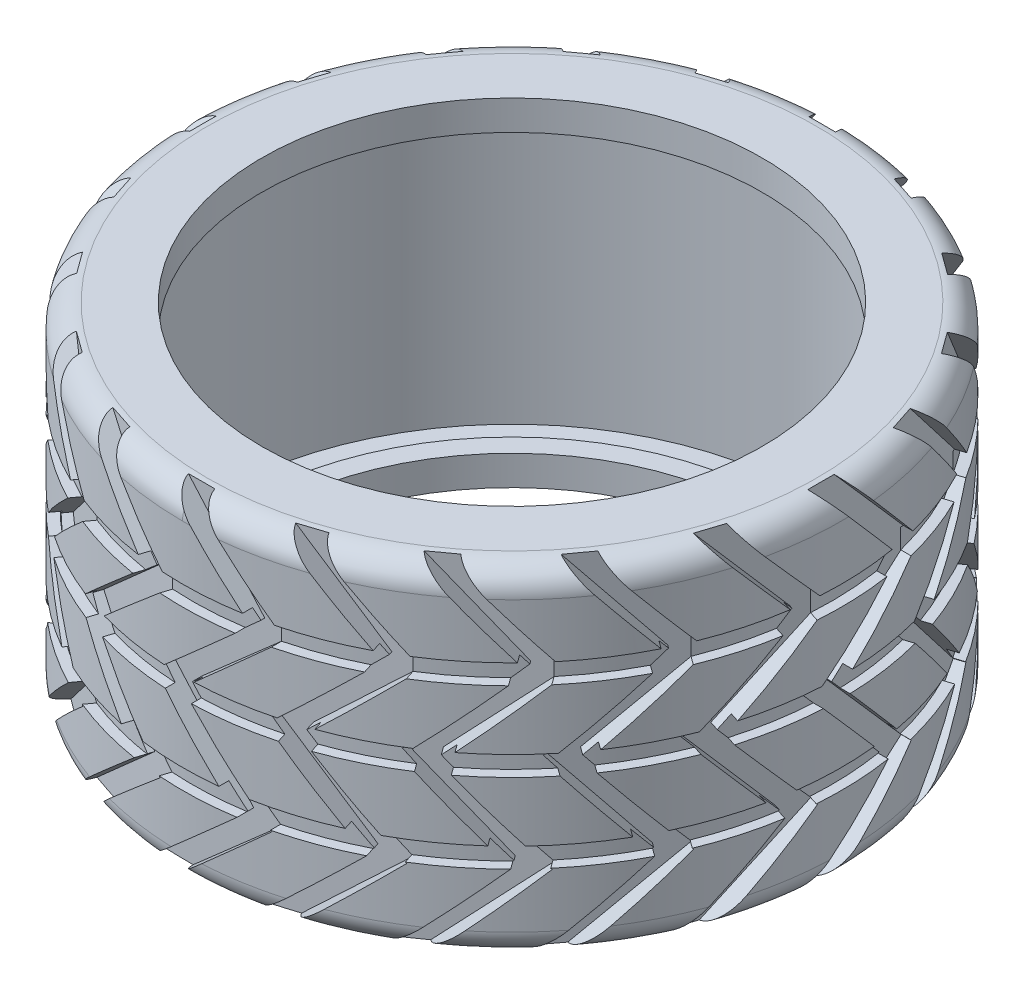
SolidWorks part; units mm, degrees
ref_plane "Front Plane" through (0, 0, 0) normal (0, 0, 1) x (1, 0, 0)
ref_plane "Top Plane" through (0, 0, 0) normal (0, 1, 0) x (1, 0, 0)
ref_plane "Right Plane" through (0, 0, 0) normal (1, 0, 0) x (0, 0, -1)
sketch "Sketch1" plane through (0, 0, 0) normal (0, 0, 1) x (1, 0, 0)
  line L0 (0, 83.6379) -> (0, -103.1897) construction
  line L1 (30.7, -17) -> (25.2, -17)
  line L2 (25.2, -17) -> (25.2, -14)
  line L3 (25.2, -14) -> (27.2, -14)
  line L4 (27.2, -14) -> (27.2, -15)
  line L5 (30.2, 15) -> (30.2, -15)
  line L6 (27.2, -15) -> (30.2, -15)
  line L7 (27.2, 15) -> (30.2, 15)
  line L8 (27.2, 14) -> (27.2, 15)
  line L9 (25.2, 14) -> (27.2, 14)
  line L10 (-63.3434, 0) -> (33.2, 0) construction
  line L11 (25.2, 17) -> (25.2, 14)
  line L12 (33.2, 14.5) -> (33.2, -14.5)
  line L13 (30.7, 17) -> (25.2, 17)
  arc A0 (33.2, -14.5) -> (30.7, -17) centre (30.7, -14.5) cw
  arc A1 (33.2, 14.5) -> (30.7, 17) centre (30.7, 14.5) ccw
  point P19 (34, -19)
  point P21 (30.2, 0)
  point P24 (34, 19)
  dimension "D8" = 2.5
  dimension "D1" = 30.2
  dimension "D2" = 2
  dimension "D3" = 2
  dimension "D4" = 15
  dimension "D5" = 3
  dimension "D6" = 3
  dimension "D7" = 3
revolve "Revolve1" add sketch "Sketch1" angle 360 about L0
sketch "Sketch2" plane through (0, 0, 0) normal (0, 0, 1) x (1, 0, 0)
  line L0 (-5.8704, 0) -> (53.8139, 0) construction
  line L1 (32.2, 9) -> (35.7422, 9)
  line L2 (32.2, 9) -> (32.2, 7)
  line L3 (32.2, 7) -> (35.7422, 7)
  line L4 (35.7422, 9) -> (35.7422, 7)
  line L5 (32.2, 1) -> (35.7422, 1)
  line L6 (32.2, 1) -> (32.2, -1)
  line L7 (32.2, -1) -> (35.7422, -1)
  line L8 (35.7422, 1) -> (35.7422, -1)
  line L9 (32.2, -7) -> (35.7422, -7)
  line L10 (32.2, -7) -> (32.2, -9)
  line L11 (32.2, -9) -> (35.7422, -9)
  line L12 (35.7422, -7) -> (35.7422, -9)
  line L13 (33.2, -14.5) -> (33.2, 14.5) construction
  line L14 (0, 29.8282) -> (0, -32.6074) construction
  line L15 (0, -32.6074) -> (-0.69, -32.6074) construction
  dimension "D1" = 2
  dimension "D2" = 1
  dimension "D3" = 9
revolve "Cut-Revolve1" cut sketch "Sketch2" angle 360 about L14
ref_plane "Plane1" through (33.2, 0, 0) normal (1, 0, 0) x (0, 0, -1)
sketch "Sketch3" plane through (33.2, 0, 0) normal (1, 0, 0) x (0, 0, -1)
  line L0 (0, 0) -> (9.1133, 8)
  line L1 (9.1133, 8) -> (1.1133, 17.1133)
  line L2 (0, 0) -> (8, -9.1133)
  line L3 (8, -9.1133) -> (-1.1133, -17.1133)
  line L4 (2.3901, 8) -> (13.9243, 8) construction
  line L5 (0, 18.3998) -> (0, -22.4709) construction
  line L6 (6.2909, 8.1836) -> (-0.3897, 15.7939) construction
  line L7 (1.1133, 17.1133) -> (-1.548, 17.1133)
  line L8 (-0.2479, 15.6324) -> (-1.548, 17.1133)
  line L9 (-2.4327, -15.6103) -> (-4.1449, -17.1133)
  line L10 (-32.2, 9) -> (32.2, 9) construction
  line L11 (33.2, 7) -> (-33.2, 7) construction
  line L12 (5.1775, -8.9297) -> (-2.4327, -15.6103)
  line L13 (-2.8225, 0.1836) -> (5.1775, -8.9297)
  line L14 (-2.8225, 0.1836) -> (6.2909, 8.1836)
  line L15 (6.2909, 8.1836) -> (-0.2479, 15.6324)
  line L16 (-1.1133, -17.1133) -> (-4.1449, -17.1133)
  dimension "D1" = 2
extrude "Cut-Extrude1" cut sketch "Sketch3" against normal blind 2
pattern_circular "CirPattern1" count 20 over 360 about axis through (0, 0, 0) along (0, 1, 0) of "Cut-Extrude1"
